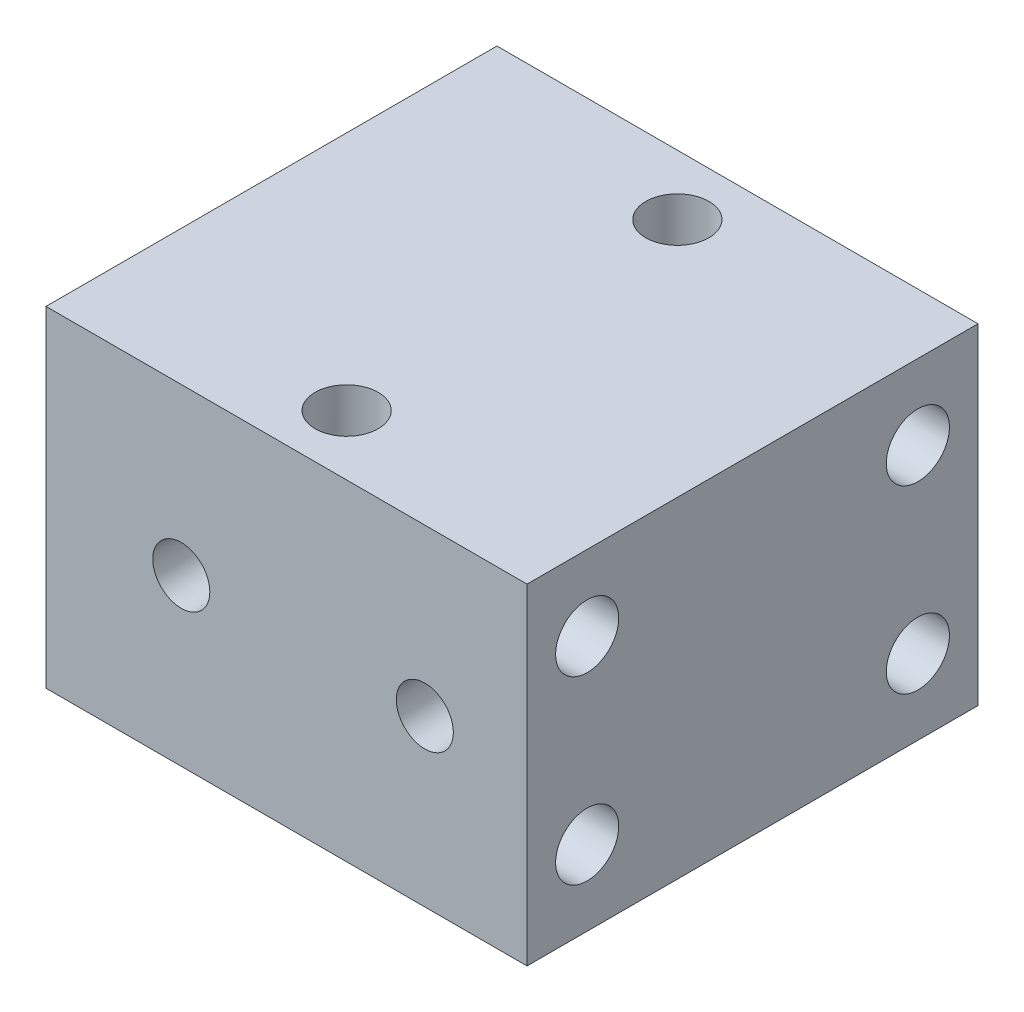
SolidWorks part; units mm, degrees
ref_plane "Front Plane" through (0, 0, 0) normal (0, 0, 1) x (1, 0, 0)
ref_plane "Top Plane" through (0, 0, 0) normal (0, 1, 0) x (1, 0, 0)
ref_plane "Right Plane" through (0, 0, 0) normal (1, 0, 0) x (0, 0, -1)
sketch "Sketch1" plane through (0, 0, 0) normal (0, 1, 0) x (1, 0, 0)
  line L0 (0, 27.5) -> (0, -27.5) construction
  line L1 (-40, 37.5) -> (40, 37.5)
  line L2 (-40, 37.5) -> (-40, -37.5)
  line L3 (-40, -37.5) -> (40, -37.5)
  line L4 (40, 37.5) -> (40, -37.5)
  line L5 (-40, 0) -> (0, 0) construction
  circle A0 centre (0, 27.5) radius 5.25
  circle A1 centre (0, -27.5) radius 5.25
  dimension "D5" = 10.5
  dimension "D6" = 10.5
  dimension "D8" = 40
  dimension "D1" = 75
  dimension "D2" = 37.5
  dimension "D3" = 80
  dimension "D4" = 40
  dimension "D7" = 55
extrude "H1" add sketch "Sketch1" along normal blind 55
sketch "Sketch2" plane through (-40, 0, 0) normal (-1, 0, 0) x (0, 0, 1)
  line L0 (0, 0) -> (0, 27.5) construction
  line L1 (37.5, 27.5) -> (0, 27.5) construction
  line L2 (37.5, 55) -> (37.5, 0) construction
  circle A0 centre (0, 27.5) radius 0.5
  dimension "D1" = 1
extrude "CENTER HOLE" cut sketch "Sketch2" against normal blind 60
hole_wizard "1/8 NPT Tapped Hole1" positions "Sketch4" profile "Sketch3" size "1/8" standard "Ansi Inch"
sketch "Sketch4" plane through (0, 0, 37.5) normal (0, 0, 1) x (1, 0, 0)
  line L0 (-40, 27.5) -> (40, 27.5) construction
  line L1 (-40, 55) -> (-40, 0) construction
  line L2 (40, 55) -> (40, 0) construction
  point P0 (23, 27.5)
  point P1 (-17.5, 27.5)
  dimension "D1" = 22.5
  dimension "D2" = 17
sketch "Sketch3" plane through (23, 27.5, 37.5) normal (1, 0, 0) x (0, -1, 0)
  line L0 (0, 0) -> (0, 14.1535)
  line L1 (4.2164, 11.62) -> (0, 14.1535)
  line L2 (-4.2164, 11.62) -> (0, 14.1535) construction
  line L3 (4.2164, 11.62) -> (4.2164, 6.92)
  line L4 (4.2164, 6.92) -> (4.5374, 6.92)
  line L5 (4.5374, 6.92) -> (4.7446, 0)
  line L6 (-4.5374, 6.92) -> (-4.7446, 0) construction
  line L7 (4.7446, 0) -> (0, 0)
  line L8 (0, -6.35) -> (0, 107.95) construction
  line L11 (-4.2164, 6.92) -> (-4.5374, 6.92) construction
  dimension "Tap Drill Dia." = 8.4328
  dimension "Tap Drill Depth" = 11.62
  dimension "Thread Dia." = 9.4892
  dimension "Thread Angle" = 3.43
  dimension "Thread Depth" = 6.92
  dimension "Drill Angle" = 118
sketch "Sketch6" plane through (-40, 0, 0) normal (-1, 0, 0) x (0, 0, 1)
  line L0 (-27.5, 55) -> (-27.5, 0) construction
  line L1 (27.5, 55) -> (27.5, 0) construction
  line L3 (-27.5, 42.5) -> (27.5, 42.5) construction
  line L5 (-27.5, 12.5) -> (27.5, 12.5) construction
  circle A0 centre (-27.5, 42.5) radius 5.25
  circle A1 centre (-27.5, 12.5) radius 5.25
  circle A2 centre (27.5, 42.5) radius 5.25
  circle A3 centre (27.5, 12.5) radius 5.25
  dimension "D3" = 10.5
  dimension "D1" = 15
  dimension "D2" = 30
extrude "MTG HOLE" cut sketch "Sketch6" against normal up to surface (80 mm away)
sketch "Sketch5" plane through (0, 0, 37.5) normal (0, 0, 1) x (1, 0, 0)
  circle A0 centre (-17.5, 27.5) radius 2
  circle A1 centre (23, 27.5) radius 2
  circle A2 centre (23, 27.5) radius 4.7446 construction
  circle A3 centre (-17.5, 27.5) radius 4.7446 construction
  dimension "D1" = 4
  dimension "D2" = 4
extrude "OIL HOLE" cut sketch "Sketch5" against normal blind 20
equation "\"D1@Sketch6\" = \"D2@Sketch6\" / 2"
equation "\"D5@Sketch1\" = \"D6@Sketch1\""
equation "\"D2@Sketch1\" = \"D1@Sketch1\"/2"
equation "\"D4@Sketch1\"=\"D3@Sketch1\" / 2"
